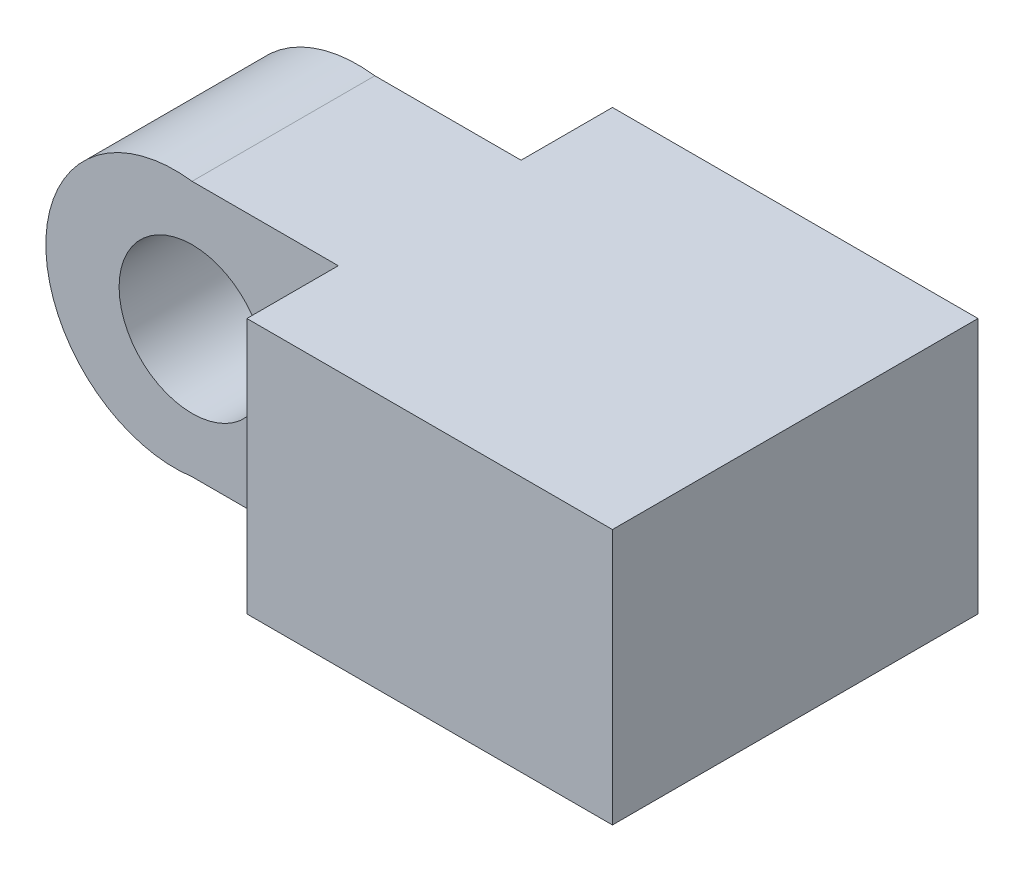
SolidWorks part; units mm, degrees
ref_plane "Plan de face" through (0, 0, 0) normal (0, 0, 1) x (1, 0, 0)
ref_plane "Plan de dessus" through (0, 0, 0) normal (0, 1, 0) x (1, 0, 0)
ref_plane "Plan de droite" through (0, 0, 0) normal (1, 0, 0) x (0, 0, -1)
sketch "Esquisse1" plane through (0, 0, 0) normal (0, 1, 0) x (1, 0, 0)
  line L1 (0, 0) -> (10, 0)
  line L2 (0, 0) -> (0, 10)
  line L3 (0, 10) -> (10, 10)
  line L4 (10, 0) -> (10, 10)
  dimension "D1" = 10
  dimension "D2" = 10
extrude "Boss.-Extru.1" add sketch "Esquisse1" along normal blind 7
sketch "Esquisse2" plane through (0, 0, 0) normal (0, 0, 1) x (1, 0, 0)
  line L1 (0, 7) -> (0, 0)
  line L4 (-4, 0) -> (0, 0)
  line L5 (0, 7) -> (-4, 7)
  arc A0 (-4, 0) -> (-4, 7) centre (-4.4688, 3.5) cw
extrude "Boss.-Extru.2" add sketch "Esquisse2" against normal blind 10
sketch "Esquisse3" plane through (0, 7, 0) normal (0, 1, 0) x (1, 0, 0)
  line L0 (0, 0) -> (0, 10) construction
  line L1 (10, 10) -> (-4, 10) construction
sketch "Esquisse6" plane through (0, 0, 0) normal (0, 0, 1) x (1, 0, 0)
  line L0 (-8, 7) -> (-8, 0) construction
  line L1 (-4, 0) -> (10, 0) construction
  circle A0 centre (-3.9963, 3.5) radius 2
  dimension "D2" = 4
  dimension "D1" = 4.0037
  dimension "D3" = 3.5
extrude "Enlèv. mat.-Extru.1" cut sketch "Esquisse6" against normal through all
sketch "Esquisse7" plane through (0, 7, 0) normal (0, 1, 0) x (1, 0, 0)
  line L0 (-4, 0) -> (10, 0) construction
  line L1 (0, 2.5) -> (-8.5341, 2.5)
  line L2 (0, 2.5) -> (0, 7.5)
  line L3 (0, 7.5) -> (-8.5341, 7.5)
  line L4 (-8.5341, 2.5) -> (-8.5341, 7.5)
  line L5 (10, 10) -> (-4, 10) construction
  dimension "D1" = 2.5
  dimension "D2" = 2.5
sketch "Esquisse8" plane through (0, 0, 0) normal (0, 1, 0) x (1, 0, 0)
  line L0 (10, 10) -> (-4, 10) construction
  line L1 (0, 0) -> (-9.9971, 0)
  line L2 (0, 0) -> (0, 2.5)
  line L3 (0, 2.5) -> (-9.9971, 2.5)
  line L4 (-9.9971, 0) -> (-9.9971, 2.5)
  line L5 (0, 10) -> (-9.6402, 10)
  line L6 (0, 10) -> (0, 7.5)
  line L7 (0, 7.5) -> (-9.6402, 7.5)
  line L8 (-9.6402, 10) -> (-9.6402, 7.5)
extrude "Enlèv. mat.-Extru.5" cut sketch "Esquisse8" against normal through all both and the other way through all
